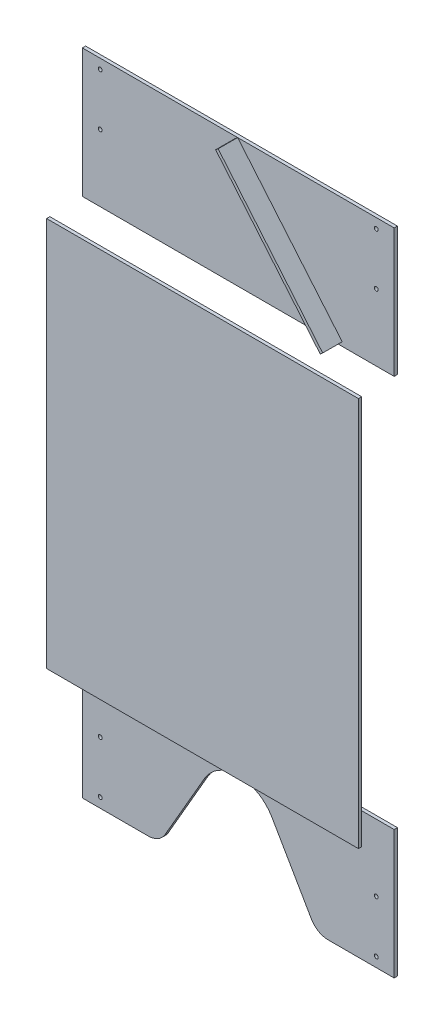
SolidWorks part; units mm, degrees
ref_plane "Ebene vorne" through (0, 0, 0) normal (0, 0, 1) x (1, 0, 0)
ref_plane "Ebene oben" through (0, 0, 0) normal (0, 1, 0) x (1, 0, 0)
ref_plane "Ebene rechts" through (0, 0, 0) normal (1, 0, 0) x (0, 0, -1)
sketch "Skizze1" plane through (0, 0, 0) normal (0, 0, 1) x (1, 0, 0)
  line L4 (240, 0) -> (-240, 0)
  line L9 (138.5641, -1000) -> (240, -1000)
  line L10 (-240, -1000) -> (-138.5641, -1000)
  line L11 (-112.5833, -985) -> (-51.9615, -880)
  line L12 (112.5833, -985) -> (51.9615, -880)
  line L45 (0, -910) -> (0, 0) construction
  line L46 (-240, 0) -> (-240, -1000)
  line L47 (240, 0) -> (240, -1000)
  arc A8 (51.9615, -880) -> (-51.9615, -880) centre (0, -910) ccw
  arc A9 (-138.5641, -1000) -> (-112.5833, -985) centre (-138.5641, -970) ccw
  arc A10 (112.5833, -985) -> (138.5641, -1000) centre (138.5641, -970) ccw
  circle A43 centre (212.5, -905) radius 3
  circle A44 centre (212.5, -985) radius 3
  circle A45 centre (-212.5, -905) radius 3
  circle A46 centre (-212.5, -985) radius 3
  circle A47 centre (212.5, -95) radius 3
  circle A48 centre (212.5, -15) radius 3
  circle A49 centre (-212.5, -95) radius 3
  circle A50 centre (-212.5, -15) radius 3
  point P200 (0, 0)
  dimension "D1" = 240
extrude "Linear austragen1" add sketch "Skizze1" against normal blind 5
sketch "Skizze2" plane through (0, 0, -5) normal (0, 0, -1) x (-1, 0, 0)
  line L0 (180, -225) -> (180, -775)
  line L1 (-240, -1000) -> (-240, 0) construction
  line L2 (-240, -500) -> (0, -500) construction
  line L3 (0, -500) -> (0, 0) construction
  line L4 (-240, -225) -> (-180, -225)
  line L5 (-240, -225) -> (-240, -775)
  line L6 (-240, -775) -> (-180, -775)
  line L7 (-180, -225) -> (-180, -775)
  line L8 (240, -775) -> (180, -775)
  line L9 (240, -225) -> (240, -775)
  line L10 (240, -225) -> (180, -225)
  circle A0 centre (0, -500) radius 290 construction
  dimension "D1" = 580
  dimension "D2" = 550
  dimension "D3" = 60
sketch "Skizze3" plane through (0, 0, 0) normal (0, 0, 1) x (1, 0, 0)
  line L0 (0, 0) -> (0, -500) construction
  line L1 (-240, -635) -> (240, -635)
  line L2 (-240, -635) -> (-240, -595)
  line L3 (-240, -595) -> (240, -595)
  line L4 (240, -635) -> (240, -595)
  line L5 (0, -500) -> (-240, -500) construction
  line L6 (-240, -225) -> (-240, -775) construction
  line L7 (240, -225) -> (240, -775) construction
  line L8 (240, -365) -> (240, -405)
  line L9 (-240, -405) -> (240, -405)
  line L10 (-240, -365) -> (-240, -405)
  line L11 (-240, -365) -> (240, -365)
  line L12 (-240, -217.5) -> (240, -217.5) construction
  line L13 (-240, 0) -> (-240, -1000) construction
  line L14 (240, -1000) -> (240, 0) construction
  line L15 (-240, -782.5) -> (240, -782.5) construction
  dimension "D1" = 40
  dimension "D2" = 190
  dimension "D3" = 565
sketch "Skizze4" plane through (0, 0, -5) normal (0, 0, -1) x (-1, 0, 0)
  line L0 (-240, -500) -> (241.182, -500) construction
  line L1 (-302, -198) -> (0, -198) construction
  line L2 (348, -802) -> (-302, -802)
  line L3 (-302, -802) -> (-302, -198)
  line L4 (-302, -198) -> (348, -198)
  line L5 (348, -800) -> (-300, -800)
  line L6 (0, -500) -> (0, -708.657) construction
  line L7 (-300, -800) -> (-300, -200)
  line L8 (-300, -200) -> (348, -200)
  line L9 (-300, -200) -> (0, -200) construction
  line L10 (0, -802) -> (-302, -802) construction
  line L11 (0, -800) -> (-300, -800) construction
  line L12 (348, -802) -> (348, -800)
  line L13 (348, -200) -> (348, -198)
  circle A0 centre (0, -500) radius 300 construction
  arc A4 (0, -802) -> (0, -198) centre (0, -500) ccw construction
  arc A5 (0, -800) -> (0, -200) centre (0, -500) ccw construction
  point P23 (0, 0)
  dimension "D4" = 650
  dimension "D1" = 600
  dimension "D3" = 2
extrude "Schnitt-Linear austragen1" cut sketch "Skizze4" against normal through all
move or copy body "Körper-Verschieben/Kopieren1" bodies to move or copy 117 116
sketch "Skizze5" plane through (0, 0, -55) normal (0, 0, 1) x (1, 0, 0)
  line L0 (-0.9276, 0) -> (160, -191.7861)
  line L1 (240, 0) -> (-240, 0) construction
  line L2 (160, -191.7861) -> (156.1698, -195)
  line L3 (156.1698, -195) -> (-4.7578, -3.2139)
  line L4 (-4.7578, -3.2139) -> (-0.9276, 0)
  line L5 (-240, -195) -> (240, -195) construction
  line L6 (240, -800) -> (240, -200) construction
  dimension "D1" = 5
  dimension "D2" = 80
  dimension "D3" = 50
extrude "Linear austragen2" add sketch "Skizze5" along normal blind 30
equation "\"Radius\"=0"
equation "\"Stückzahl\"= 1"
